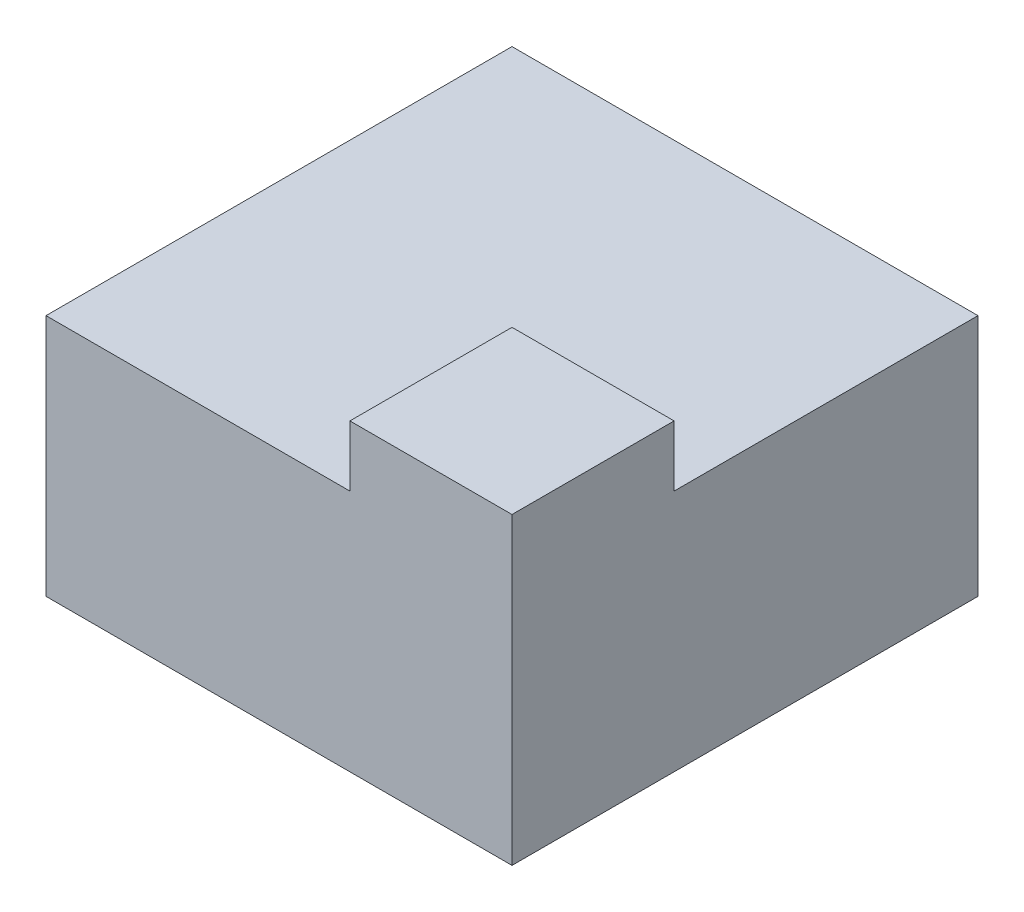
SolidWorks part; units mm, degrees
ref_plane "Front Plane" through (0, 0, 0) normal (0, 0, 1) x (1, 0, 0)
ref_plane "Top Plane" through (0, 0, 0) normal (0, 1, 0) x (1, 0, 0)
ref_plane "Right Plane" through (0, 0, 0) normal (1, 0, 0) x (0, 0, -1)
sketch "Sketch1" plane through (0, 0, 0) normal (0, 1, 0) x (1, 0, 0)
  line L1 (-115, 57.5) -> (115, 57.5)
  line L2 (-115, 57.5) -> (-115, -57.5)
  line L3 (-115, -57.5) -> (115, -57.5)
  line L4 (115, 57.5) -> (115, -57.5)
  line L5 (-115, 57.5) -> (115, -57.5) construction
  line L6 (-115, -57.5) -> (115, 57.5) construction
  point P0 (0, 0)
  dimension "D1" = 230
  dimension "D2" = 115
extrude "Boss-Extrude1" add sketch "Sketch1" along normal mid plane 75
sketch "Sketch2" plane through (0, 37.5, 0) normal (0, 1, 0) x (1, 0, 0)
  line L0 (-115, -57.5) -> (115, -57.5) construction
  line L1 (-115, 57.5) -> (-40, 57.5)
  line L2 (-115, 57.5) -> (-115, -57.5)
  line L3 (-115, -57.5) -> (-40, -57.5)
  line L4 (-40, 57.5) -> (-40, -57.5)
  dimension "D1" = 75
extrude "Cut-Extrude1" cut sketch "Sketch2" against normal blind 15
sketch "Sketch4" plane through (0, 37.5, 0) normal (0, 1, 0) x (1, 0, 0)
  line L0 (115, -57.5) -> (115, 57.5) construction
  line L1 (-40, 57.5) -> (115, 57.5)
  line L2 (-40, 57.5) -> (-40, -17.5)
  line L3 (-40, -17.5) -> (115, -17.5)
  line L4 (115, 57.5) -> (115, -17.5)
  dimension "D1" = 75
extrude "Cut-Extrude3" cut sketch "Sketch4" against normal blind 15
sketch "Sketch5" plane through (115, 0, 0) normal (1, 0, 0) x (0, 0, -1)
  line L0 (-57.5, 37.5) -> (-17.5, 37.5) construction
  line L1 (-17.5, 22.5) -> (-17.5, 37.5) construction
  line L2 (-57.5, 37.5) -> (-57.5, -37.5) construction
  line L3 (-57.5, -37.5) -> (57.5, -37.5) construction
  line L4 (57.5, 22.5) -> (57.5, -37.5) construction
  line L5 (-17.5, 22.5) -> (57.5, 22.5) construction
  line L6 (-57.5, 37.5) -> (-17.5, 37.5)
  line L7 (-17.5, 22.5) -> (-17.5, 37.5)
  line L8 (-57.5, 37.5) -> (-57.5, -37.5)
  line L9 (-57.5, -37.5) -> (57.5, -37.5)
  line L10 (57.5, 22.5) -> (57.5, -37.5)
  line L11 (-17.5, 22.5) -> (57.5, 22.5)
extrude "Cut-Extrude4" cut sketch "Sketch5" against normal blind 115
